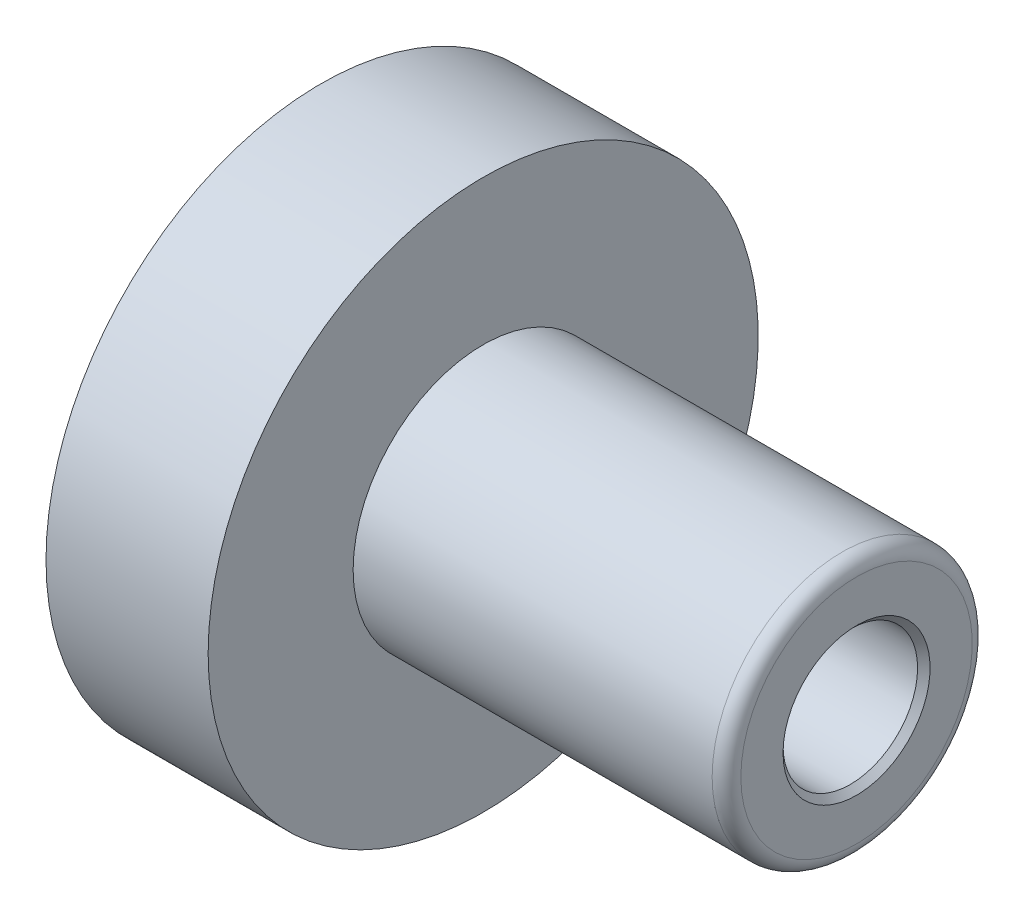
SolidWorks part; units mm, degrees
ref_plane "Front Plane" through (0, 0, 0) normal (0, 0, 1) x (1, 0, 0)
ref_plane "Top Plane" through (0, 0, 0) normal (0, 1, 0) x (1, 0, 0)
ref_plane "Right Plane" through (0, 0, 0) normal (1, 0, 0) x (0, 0, -1)
sketch "Sketch1" plane through (0, 0, 0) normal (0, 0, 1) x (1, 0, 0)
  line L0 (0, 0) -> (102.3864, 0) construction
  line L1 (0, 9.906) -> (0, 30.1625)
  line L2 (0, 30.1625) -> (17.78, 30.1625)
  line L3 (17.78, 30.1625) -> (17.78, 14.2621)
  line L4 (17.78, 14.2621) -> (57.15, 14.2621)
  line L5 (58.7248, 12.6873) -> (58.7248, 0)
  line L6 (58.7248, 0) -> (33.3502, 0)
  line L7 (0, 9.906) -> (33.3502, 9.906)
  line L8 (33.3502, 9.906) -> (33.3502, 0)
  arc A0 (58.7248, 12.6873) -> (57.15, 14.2621) centre (57.15, 12.6873) ccw
  dimension "D5" = 1.5748
  dimension "D1" = 17.78
  dimension "D2" = 60.325
  dimension "D3" = 33.3502
  dimension "D4" = 19.812
  dimension "D6" = 58.7248
  dimension "D7" = 28.5242
revolve "Revolve1" add sketch "Sketch1" angle 360 about L0
sketch "Sketch2" plane through (0, 0, 0) normal (-1, 0, 0) x (0, 0, 1)
  line L0 (0, 0) -> (9.7644, 0) construction
  circle A0 centre (0, 19.939) radius 3.2004
  circle A1 centre (0, -19.939) radius 3.2004
  dimension "D2" = 6.4008
  dimension "D1" = 39.878
extrude "Cut-Extrude1" cut sketch "Sketch2" against normal blind 7.9502
sketch "Sketch3" plane through (58.7248, 0, 0) normal (1, 0, 0) x (0, 0, -1)
  circle A0 centre (0, 0) radius 7.3787
  dimension "D1" = 14.7574
extrude "Cut-Extrude2" cut sketch "Sketch3" against normal blind 22.8092
chamfer "Chamfer1" distance 0.6858 angle 45 1 edges at (58.7248, 0, -7.3787)
